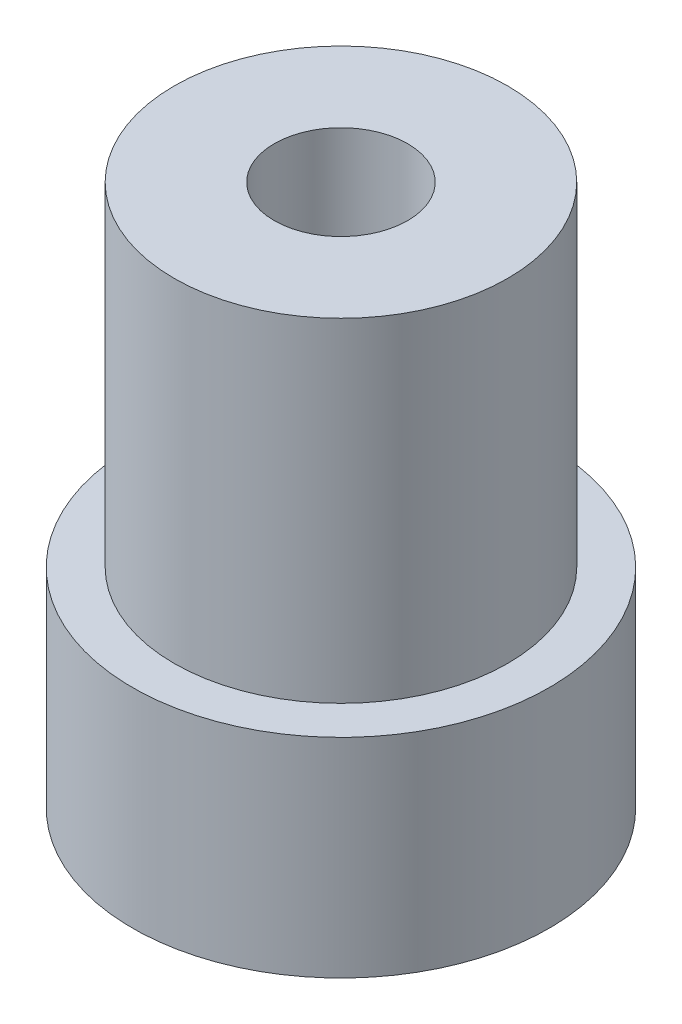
SolidWorks part; units mm, degrees
ref_plane "前视基准面" through (0, 0, 0) normal (0, 0, 1) x (1, 0, 0)
ref_plane "上视基准面" through (0, 0, 0) normal (0, 1, 0) x (1, 0, 0)
ref_plane "右视基准面" through (0, 0, 0) normal (1, 0, 0) x (0, 0, -1)
sketch "草图1" plane through (0, 0, 0) normal (0, 1, 0) x (1, 0, 0)
  circle A0 centre (0, 0) radius 4
  circle A1 centre (0, 0) radius 1.6
  dimension "D1" = 8
  dimension "D2" = 3.2
extrude "凸台-拉伸1" add sketch "草图1" along normal blind 8 contours A1 | A0
sketch "草图2" plane through (0, 0, 0) normal (0, -1, 0) x (1, 0, 0)
  line L1 (3.3198, 0) -> (1.6599, 2.875)
  line L2 (1.6599, 2.875) -> (-1.6599, 2.875)
  line L3 (-1.6599, 2.875) -> (-3.3198, 0)
  line L4 (-3.3198, 0) -> (-1.6599, -2.875)
  line L5 (-1.6599, -2.875) -> (1.6599, -2.875)
  line L6 (1.6599, -2.875) -> (3.3198, 0)
  circle A0 centre (0, 0) radius 5
  circle A1 centre (0, 0) radius 2.875 construction
  dimension "D1" = 10
  dimension "D2" = 5.75
extrude "凸台-拉伸2" add sketch "草图2" along normal blind 5 separate body
sketch "草图3" plane through (0, 0, 0) normal (0, -1, 0) x (1, 0, 0)
  line L1 (3.3198, 0) -> (1.6599, 2.875)
  line L2 (1.6599, 2.875) -> (-1.6599, 2.875)
  line L3 (-1.6599, 2.875) -> (-3.3198, 0)
  line L4 (-3.3198, 0) -> (-1.6599, -2.875)
  line L5 (-1.6599, -2.875) -> (1.6599, -2.875)
  line L6 (1.6599, -2.875) -> (3.3198, 0)
  circle A0 centre (0, 0) radius 2.875 construction
  circle A1 centre (0, 0) radius 1.6
extrude "凸台-拉伸3" add sketch "草图3" along normal blind 2
